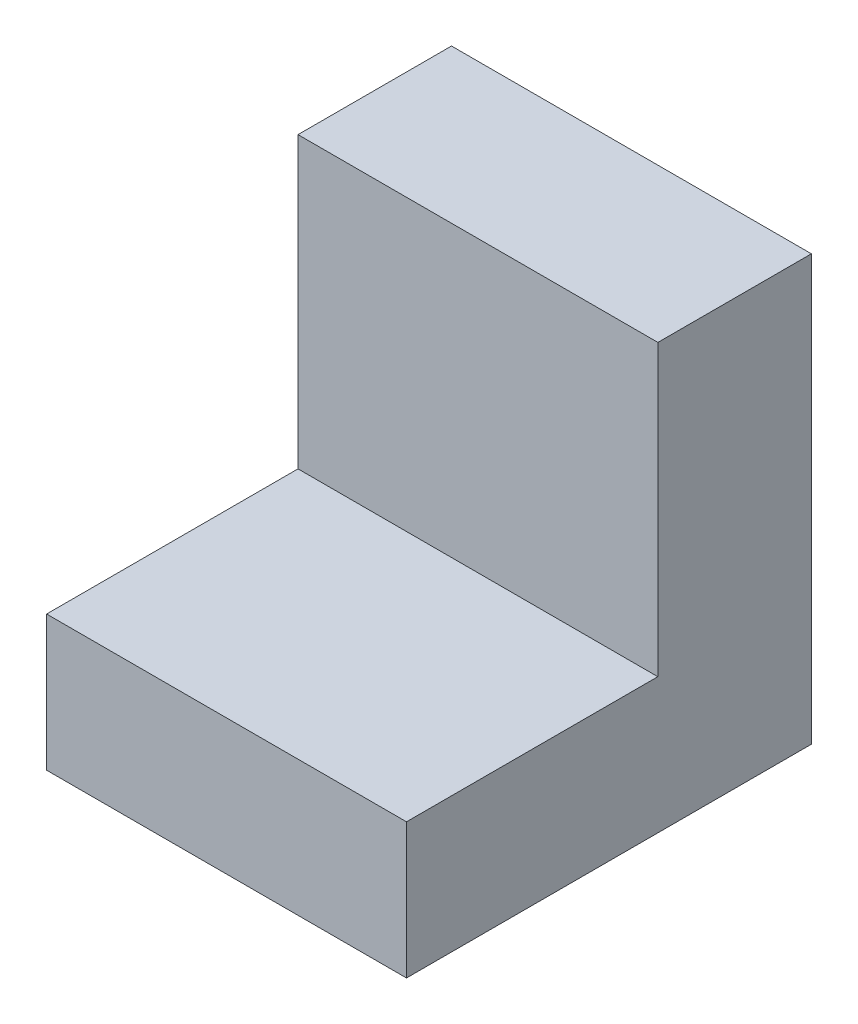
SolidWorks part; units mm, degrees
ref_plane "Front Plane" through (0, 0, 0) normal (0, 0, 1) x (1, 0, 0)
ref_plane "Top Plane" through (0, 0, 0) normal (0, 1, 0) x (1, 0, 0)
ref_plane "Right Plane" through (0, 0, 0) normal (1, 0, 0) x (0, 0, -1)
sketch "Sketch1" plane through (0, 0, 0) normal (1, 0, 0) x (0, 0, -1)
  line L0 (0, 0) -> (131.1635, 0)
  line L1 (131.1635, 0) -> (131.1635, 137.5927)
  line L2 (131.1635, 137.5927) -> (81.4378, 137.5927)
  line L3 (81.4378, 137.5927) -> (81.4378, 43.8231)
  line L6 (81.4378, 43.8231) -> (0, 43.8231)
  line L7 (0, 43.8231) -> (0, 0)
extrude "Extrude1" add sketch "Sketch1" along normal blind 116.586
sketch "Sketch2" plane through (0, 43.8231, 0) normal (0, 1, 0) x (-1, 0, 0)
  line L1 (-5.3253, -81.4378) -> (-116.586, -81.4124)
  line L2 (-116.586, -81.4378) -> (0, -81.4378) construction
  line L3 (-116.586, -81.4378) -> (-116.586, 0) construction
  line L4 (-116.586, -81.4124) -> (-116.586, -81.4378)
  line L5 (-116.586, -81.4378) -> (-5.3253, -81.4378)
  dimension "D1" = 0.0254
extrude "Cut-Extrude1" cut sketch "Sketch2" against normal blind 14.986
